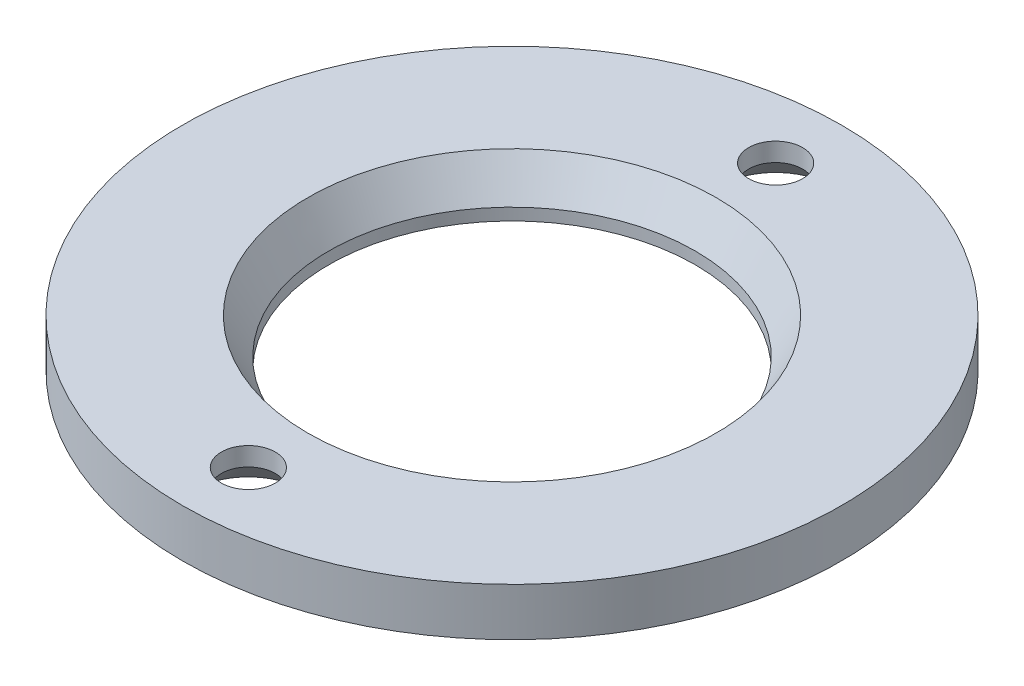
SolidWorks part; units mm, degrees
ref_plane "Front Plane" through (0, 0, 0) normal (0, 0, 1) x (1, 0, 0)
ref_plane "Top Plane" through (0, 0, 0) normal (0, 1, 0) x (1, 0, 0)
ref_plane "Right Plane" through (0, 0, 0) normal (1, 0, 0) x (0, 0, -1)
sketch "Sketch1" plane through (0, 0, 0) normal (0, 1, 0) x (1, 0, 0)
  circle A0 centre (0, 0) radius 27.5
  dimension "D1" = 55
extrude "Boss-Extrude1" add sketch "Sketch1" along normal blind 4
sketch "Sketch2" plane through (0, 0, 0) normal (1, 0, 0) x (0, 0, -1)
  line L0 (0, 0) -> (0, 4)
  line L1 (27.5, 4) -> (-27.5, 4) construction
  line L2 (0, 4) -> (17.0321, 4)
  line L3 (17.0321, 4) -> (15.3, 1)
  line L4 (15.3, 1) -> (15.3, 0)
  line L5 (15.3, 0) -> (0, 0)
  dimension "D1" = 60
  dimension "D2" = 15.3
  dimension "D3" = 1
revolve "Cut-Revolve1" cut sketch "Sketch2" angle 360 about L0
hole_wizard "CSK for M4 Flat Head Machine Screw1" positions "Sketch6" profile "Sketch5" countersink size "M4" standard "ANSI Metric"
sketch "Sketch6" plane through (0, 0, 0) normal (0, -1, 0) x (-1, 0, 0)
  line L0 (0, -22) -> (0, 0) construction
  line L1 (0, 0) -> (0, 22) construction
  point P0 (0, -22)
  point P2 (0, 22)
  dimension "D1" = 22
sketch "Sketch5" plane through (0, 0, 22) normal (1, 0, 0) x (0, 0, -1)
  line L0 (0, 0) -> (0, 4)
  line L1 (0, 4) -> (2.25, 4)
  line L2 (2.25, 4) -> (2.25, 2.45)
  line L3 (2.25, 2.45) -> (4.7, 0)
  line L5 (4.7, 0) -> (0, 0)
  line L6 (-2.25, 2.45) -> (-4.7, 0) construction
  line L11 (0, -6.35) -> (0, 107.95) construction
  dimension "Thru Hole Dia." = 4.5
  dimension "Thru Hole Depth" = 4
  dimension "Near C'Sink Dia." = 9.4
  dimension "Near C'Sink Angle" = 90
